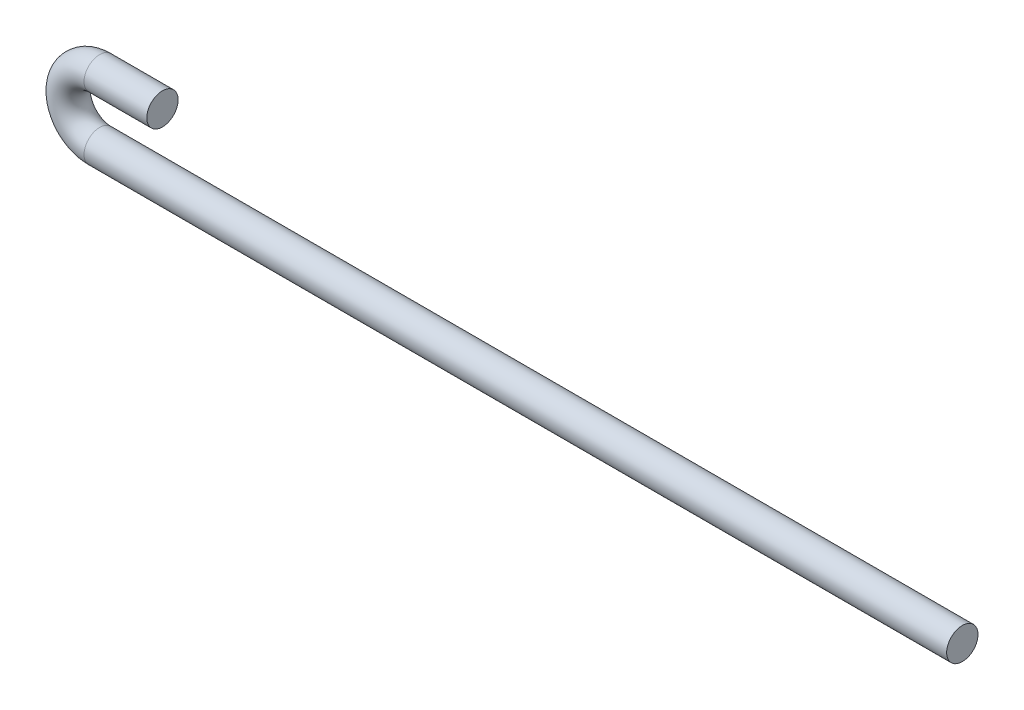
SolidWorks part; units mm, degrees
ref_plane "Front Plane" through (0, 0, 0) normal (0, 0, 1) x (1, 0, 0)
ref_plane "Top Plane" through (0, 0, 0) normal (0, 1, 0) x (1, 0, 0)
ref_plane "Right Plane" through (0, 0, 0) normal (1, 0, 0) x (0, 0, -1)
sketch "Sketch1" plane through (0, 0, 0) normal (0, 0, 1) x (1, 0, 0)
  line L0 (-4.688, 1.1252) -> (-48.3442, 1.1252)
  line L2 (-48.3442, 4.3002) -> (-45.1692, 4.3002)
  arc A0 (-48.3442, 1.1252) -> (-48.3442, 4.3002) centre (-48.3442, 2.7127) cw
  dimension "D1" = 43.6562
  dimension "D2" = 3.175
  dimension "D3" = 3.175
curve "CompCurve5"
ref_plane "Plane2" through (-4.688, 1.1252, 0) normal (-1, 0, 0) x (0, 0, 1)
sketch "Sketch4" plane through (-4.688, 1.1252, 0) normal (-1, 0, 0) x (0, 0, 1)
  circle A0 centre (0, -0.0093) radius 0.7937
  dimension "D1" = 1.5875
sweep "Sweep1" add profiles "Sketch4" path "CompCurve5"
